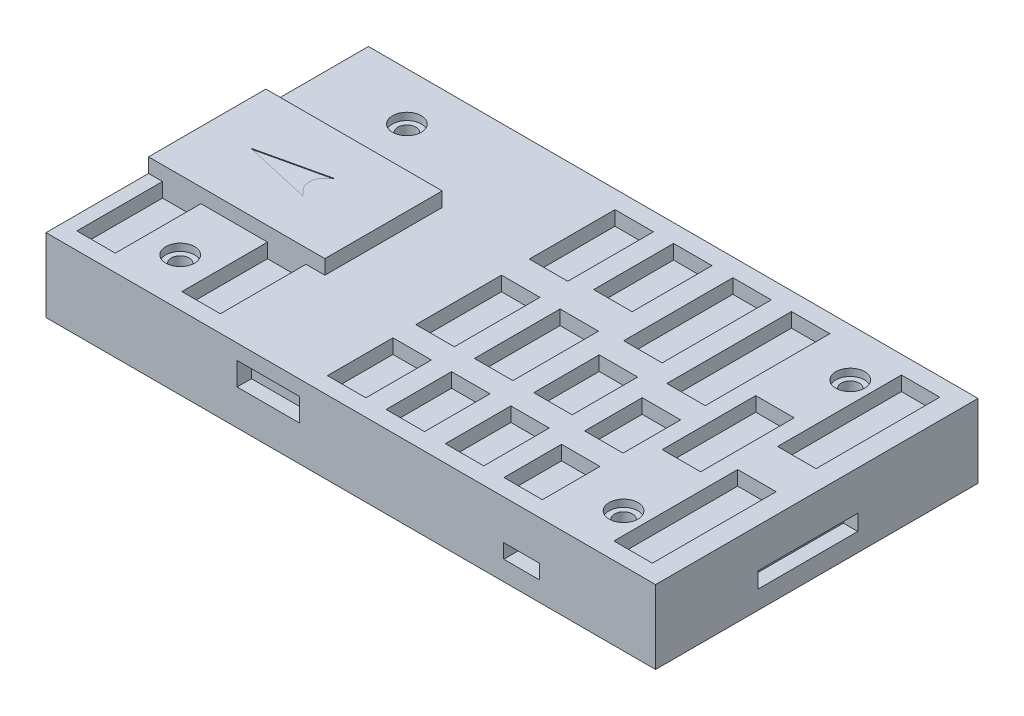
SolidWorks part; units mm, degrees
ref_plane "Front Plane" through (0, 0, 0) normal (0, 0, 1) x (1, 0, 0)
ref_plane "Top Plane" through (0, 0, 0) normal (0, 1, 0) x (1, 0, 0)
ref_plane "Right Plane" through (0, 0, 0) normal (1, 0, 0) x (0, 0, -1)
sketch "Sketch1" plane through (0, 0, 0) normal (0, 1, 0) x (1, 0, 0)
  line L0 (0, -55) -> (0, 55) construction
  line L1 (-42.35, -22.4) -> (42.35, -22.4)
  line L2 (-42.35, -22.4) -> (-42.35, 22.4)
  line L3 (-42.35, 22.4) -> (42.35, 22.4)
  line L4 (42.35, -22.4) -> (42.35, 22.4)
  line L5 (-55, 0) -> (55, 0) construction
  point P4 (0, 22.4)
  point P7 (-42.35, 0)
  dimension "D1" = 84.7
  dimension "D2" = 44.8
extrude "Boss-Extrude1" add sketch "Sketch1" along normal blind 10.22
sketch "Sketch2" plane through (0, 10.22, 0) normal (0, 1, 0) x (1, 0, 0)
  line L0 (-42.35, 22.4) -> (-42.35, -22.4) construction
  line L1 (-42.35, 8.15) -> (-17.85, 8.15)
  line L2 (-42.35, 8.15) -> (-42.35, -8.15)
  line L3 (-42.35, -8.15) -> (-17.85, -8.15)
  line L4 (-17.85, 8.15) -> (-17.85, -8.15)
  point P6 (-17.85, 0)
  dimension "D1" = 16.3
  dimension "D2" = 24.5
extrude "Boss-Extrude2" add sketch "Sketch2" along normal blind 2
sketch "Sketch3" plane through (0, 10.22, 0) normal (0, 1, 0) x (1, 0, 0)
  line L0 (42.35, 22.4) -> (-42.35, 22.4) construction
  line L1 (-5.59, -10.95) -> (-0.25, -10.95)
  line L2 (-5.59, -10.95) -> (-5.59, -20.05)
  line L3 (-5.59, -20.05) -> (-0.25, -20.05)
  line L4 (-0.25, -10.95) -> (-0.25, -20.05)
  line L5 (-5.59, 4.13) -> (-0.25, 4.13)
  line L6 (-5.59, 4.13) -> (-5.59, -7.77)
  line L7 (-5.59, -7.77) -> (-0.25, -7.77)
  line L8 (-0.25, 4.13) -> (-0.25, -7.77)
  line L9 (-5.59, 19.9) -> (-0.25, 19.9)
  line L10 (-5.59, 19.9) -> (-5.59, 8)
  line L11 (-5.59, 8) -> (-0.25, 8)
  line L12 (-0.25, 19.9) -> (-0.25, 8)
  line L13 (2.55, 19.9) -> (7.89, 19.9)
  line L14 (2.55, 19.9) -> (2.55, 8.8)
  line L15 (2.55, 8.8) -> (7.89, 8.8)
  line L16 (7.89, 19.9) -> (7.89, 8.8)
  line L17 (2.55, 4.13) -> (7.89, 4.13)
  line L18 (2.55, 4.13) -> (2.55, -7.77)
  line L19 (2.55, -7.77) -> (7.89, -7.77)
  line L20 (7.89, 4.13) -> (7.89, -7.77)
  line L21 (2.55, -10.95) -> (7.89, -10.95)
  line L22 (2.55, -10.95) -> (2.55, -20.05)
  line L23 (2.55, -20.05) -> (7.89, -20.05)
  line L24 (7.89, -10.95) -> (7.89, -20.05)
  line L25 (10.79, -20.05) -> (16.13, -20.05)
  line L26 (10.79, -20.05) -> (10.79, -10.95)
  line L27 (10.79, -10.95) -> (16.13, -10.95)
  line L28 (16.13, -20.05) -> (16.13, -10.95)
  line L29 (16.13, 1.33) -> (10.79, 1.33)
  line L30 (16.13, 1.33) -> (16.13, -7.77)
  line L31 (16.13, -7.77) -> (10.79, -7.77)
  line L32 (10.79, 1.33) -> (10.79, -7.77)
  line L33 (10.79, 19.9) -> (16.13, 19.9)
  line L34 (10.79, 19.9) -> (10.79, 4.73)
  line L35 (10.79, 4.73) -> (16.13, 4.73)
  line L36 (16.13, 19.9) -> (16.13, 4.73)
  line L37 (18.93, 19.9) -> (24.27, 19.9)
  line L38 (18.93, 19.9) -> (18.93, 2.58)
  line L39 (18.93, 2.58) -> (24.27, 2.58)
  line L40 (24.27, 19.9) -> (24.27, 2.58)
  line L41 (24.27, -0.84) -> (18.93, -0.84)
  line L42 (24.27, -0.84) -> (24.27, -8.84)
  line L43 (24.27, -8.84) -> (18.93, -8.84)
  line L44 (18.93, -0.84) -> (18.93, -8.84)
  line L45 (18.93, -12.05) -> (24.27, -12.05)
  line L46 (18.93, -12.05) -> (18.93, -20.05)
  line L47 (18.93, -20.05) -> (24.27, -20.05)
  line L48 (24.27, -12.05) -> (24.27, -20.05)
  line L49 (31.91, 7.3) -> (26.57, 7.3)
  line L50 (31.91, 7.3) -> (31.91, -5.7)
  line L51 (31.91, -5.7) -> (26.57, -5.7)
  line L52 (26.57, 7.3) -> (26.57, -5.7)
  line L53 (34.21, 19.9) -> (39.55, 19.9)
  line L54 (34.21, 19.9) -> (34.21, 2.7)
  line L55 (34.21, 2.7) -> (39.55, 2.7)
  line L56 (39.55, 19.9) -> (39.55, 2.7)
  line L57 (34.21, -2.85) -> (39.55, -2.85)
  line L58 (34.21, -2.85) -> (34.21, -20.05)
  line L59 (34.21, -20.05) -> (39.55, -20.05)
  line L60 (39.55, -2.85) -> (39.55, -20.05)
  line L62 (42.35, -22.4) -> (42.35, 22.4) construction
  line L63 (-42.35, -8.15) -> (-17.85, -8.15) construction
  line L64 (-40.41, -8.15) -> (-35.07, -8.15)
  line L65 (-40.41, -8.15) -> (-40.41, -20.05)
  line L66 (-40.41, -20.05) -> (-35.07, -20.05)
  line L67 (-35.07, -8.15) -> (-35.07, -20.05)
  line L68 (-25.82, -20.05) -> (-20.48, -20.05)
  line L69 (-25.82, -20.05) -> (-25.82, -8.15)
  line L70 (-25.82, -8.15) -> (-20.48, -8.15)
  line L71 (-20.48, -20.05) -> (-20.48, -8.15)
  dimension "D1" = 2.8
  dimension "D2" = 2.9
  dimension "D3" = 2.8
  dimension "D4" = 2.3
  dimension "D5" = 2.3
  dimension "D6" = 5.34
  dimension "D7" = 2.5
  dimension "D8" = 9.25
  dimension "D9" = 2.8
  dimension "D10" = 9.1
  dimension "D11" = 11.9
  dimension "D12" = 3.18
  dimension "D13" = 4.67
  dimension "D14" = 3.4
  dimension "D15" = 3.21
  dimension "D16" = 3.42
  dimension "D17" = 8
  dimension "D18" = 5.55
  dimension "D19" = 13
  dimension "D20" = 15.1
  dimension "D21" = 14.89
extrude "Cut-Extrude1" cut sketch "Sketch3" against normal blind 2
sketch "Sketch4" plane through (0, 0, 0) normal (0, -1, 0) x (1, 0, 0)
  line L0 (6.721, 0) -> (-6.721, 0) construction
  line L1 (-30.35, 15.75) -> (31.25, 15.75) construction
  line L2 (-30.35, 15.75) -> (-30.35, -15.75) construction
  line L3 (-30.35, -15.75) -> (31.25, -15.75) construction
  line L4 (31.25, 15.75) -> (31.25, -15.75) construction
  line L5 (42.35, 22.4) -> (42.35, -22.4) construction
  line L6 (-42.35, -22.4) -> (-42.35, 22.4) construction
  circle A0 centre (-30.35, 15.75) radius 1.25
  circle A1 centre (-30.35, -15.75) radius 1.25
  circle A2 centre (31.25, 15.75) radius 1.25
  circle A3 centre (31.25, -15.75) radius 1.25
  point P8 (-30.35, 0)
  dimension "D1" = 2.5
  dimension "D2" = 31.5
  dimension "D3" = 12
  dimension "D4" = 11.1
extrude "Cut-Extrude2" cut sketch "Sketch4" against normal through all
sketch "Sketch5" plane through (0, 10.22, 0) normal (0, 1, 0) x (1, 0, 0)
  circle A1 centre (-30.35, -15.75) radius 2
  circle A2 centre (31.25, 15.75) radius 2
  circle A3 centre (31.25, -15.75) radius 2
  circle A5 centre (-30.35, -15.75) radius 1.25 construction
  circle A7 centre (31.25, -15.75) radius 1.25 construction
  circle A8 centre (31.25, 15.75) radius 1.25 construction
  circle A9 centre (-30.35, 15.75) radius 2
  circle A10 centre (-30.35, 15.75) radius 1.25 construction
other "Pen Sketch1" parameters "D1"=14.4275
extrude "Cut-Extrude3" cut sketch "Sketch5" against normal blind 1
sketch "Sketch7" plane through (0, 0, 22.4) normal (0, 0, 1) x (1, 0, 0)
  line L0 (-42.35, 10.22) -> (42.35, 10.22) construction
  line L1 (-15.8, 8.12) -> (-7.16, 8.12)
  line L2 (-15.8, 8.12) -> (-15.8, 4.92)
  line L3 (-15.8, 4.92) -> (-7.16, 4.92)
  line L4 (-7.16, 8.12) -> (-7.16, 4.92)
  line L5 (-42.35, 10.22) -> (-42.35, 0) construction
  dimension "D1" = 3.2
  dimension "D2" = 8.64
  dimension "D3" = 2.1
  dimension "D4" = 26.55
extrude "Cut-Extrude5" cut sketch "Sketch7" against normal blind 2
sketch "Sketch8" plane through (0, 0, 22.4) normal (0, 0, 1) x (1, 0, 0)
  line L0 (-42.35, 10.22) -> (42.35, 10.22) construction
  line L1 (21.25, 4.72) -> (26.25, 4.72)
  line L2 (21.25, 4.72) -> (21.25, 2.72)
  line L3 (21.25, 2.72) -> (26.25, 2.72)
  line L4 (26.25, 4.72) -> (26.25, 2.72)
  line L5 (42.35, 10.22) -> (42.35, 0) construction
  dimension "D1" = 5.5
  dimension "D2" = 5
  dimension "D3" = 16.1
  dimension "D4" = 2
extrude "Cut-Extrude6" cut sketch "Sketch8" against normal blind 2
sketch "Sketch9" plane through (0, 0, -22.4) normal (0, 0, -1) x (-1, 0, 0)
  line L0 (-26.25, 4.72) -> (-21.25, 4.72) construction
  line L1 (-13.05, 4.85) -> (7.28, 4.85)
  line L2 (-13.05, 4.85) -> (-13.05, 1.75)
  line L3 (-13.05, 1.75) -> (7.28, 1.75)
  line L4 (7.28, 4.85) -> (7.28, 1.75)
  line L5 (-25.95, 4.72) -> (-20.45, 4.72)
  line L6 (-25.95, 4.72) -> (-25.95, 2.72)
  line L7 (-25.95, 2.72) -> (-20.45, 2.72)
  line L8 (-20.45, 4.72) -> (-20.45, 2.72)
  line L9 (-42.35, 10.22) -> (-42.35, 0) construction
  line L10 (-42.35, 10.22) -> (42.35, 10.22) construction
  dimension "D1" = 2
  dimension "D2" = 16.4
  dimension "D3" = 5.5
  dimension "D4" = 20.33
  dimension "D5" = 3.1
  dimension "D6" = 5.37
  dimension "D7" = 29.3
extrude "Cut-Extrude7" cut sketch "Sketch9" against normal blind 2
sketch "Sketch10" plane through (42.35, 0, 0) normal (1, 0, 0) x (0, 0, -1)
  line L0 (-22.4, 0) -> (22.4, 0) construction
  line L1 (-8.2, 4.76) -> (5.7, 4.76)
  line L2 (-8.2, 4.76) -> (-8.2, 2.56)
  line L3 (-8.2, 2.56) -> (5.7, 2.56)
  line L4 (5.7, 4.76) -> (5.7, 2.56)
  line L5 (22.4, 10.22) -> (22.4, 0) construction
  dimension "D1" = 13.9
  dimension "D2" = 2.2
  dimension "D3" = 2.56
  dimension "D4" = 16.7
extrude "Cut-Extrude8" cut sketch "Sketch10" against normal blind 2
sketch "Sketch11" plane through (0, 12.22, 0) normal (0, 1, 0) x (1, 0, 0)
  line L0 (-36.2824, 0) -> (-26.8824, 2.15)
  line L1 (-26.8824, 2.15) -> (-27.6172, 1.3922)
  line L2 (-27.6172, -1.3922) -> (-26.8824, -2.15)
  line L3 (-26.8824, -2.15) -> (-36.2824, 0)
  arc A0 (-27.6172, -1.3922) -> (-27.6172, 1.3922) centre (-26.1813, 0) cw
  point P11 (-28.967, 0)
  dimension "D3" = 2
  dimension "D1" = 4.3
  dimension "D2" = 9.4
extrude "Cut-Extrude9" cut sketch "Sketch11" against normal blind 0.1
ref_point "点1"
scale "缩放比例1" scale about origin uniform scaling yes scale factor 1.2
